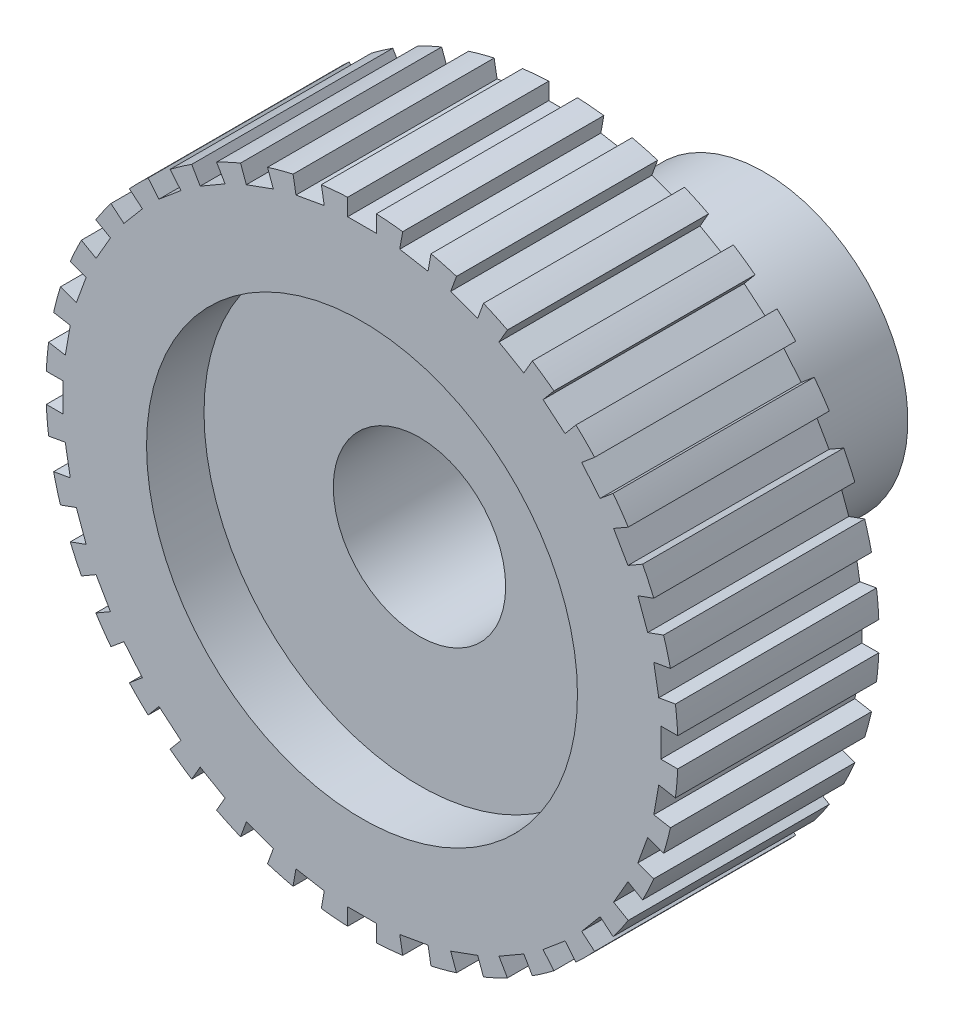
SolidWorks part; units mm, degrees
ref_plane "Plane1" through (0, 0, 0) normal (0, 0, 1) x (1, 0, 0)
ref_plane "Plane2" through (0, 0, 0) normal (0, 1, 0) x (1, 0, 0)
ref_plane "Plane3" through (0, 0, 0) normal (1, 0, 0) x (0, 0, -1)
sketch "Esquisse1" plane through (0, 0, 0) normal (0, 0, 1) x (1, 0, 0)
  circle A0 centre (0, 0) radius 11
  dimension "D1" = 22
extrude "Base-Extrusion" add sketch "Esquisse1" along normal blind 7
sketch "Esquisse2" plane through (0, 0, 7) normal (0, 0, 1) x (1, 0, 0)
  circle A0 centre (0, 0) radius 7.5
  dimension "D1" = 15
extrude "Enlèv. mat.-Extru.1" cut sketch "Esquisse2" against normal blind 2
sketch "Esquisse3" plane through (0, 0, 0) normal (0, 0, -1) x (-1, 0, 0)
  circle A0 centre (0, 0) radius 7.5
  dimension "D1" = 15
extrude "Enlèv. mat.-Extru.2" cut sketch "Esquisse3" against normal blind 1
sketch "Esquisse4" plane through (0, 0, 1) normal (0, 0, -1) x (-1, 0, 0)
  circle A0 centre (0, 0) radius 5
  dimension "D1" = 10
extrude "Boss.-Extru.1" add sketch "Esquisse4" along normal blind 8
sketch "Esquisse5" plane through (0, 0, -7) normal (0, 0, -1) x (-1, 0, 0)
  circle A0 centre (0, 0) radius 3
  dimension "D1" = 6
extrude "Enlèv. mat.-Extru.3" cut sketch "Esquisse5" against normal blind 18
sketch "Esquisse6" plane through (0, 0, 7) normal (0, 0, 1) x (1, 0, 0)
  line L0 (0, 0) -> (0, 12.6) construction
  line L1 (-0.5, 11.4) -> (0.5, 11.4)
  line L2 (-0.5, 11.4) -> (-0.5, 10.4)
  line L3 (0.5, 10.4) -> (-0.5, 10.4)
  line L4 (0.5, 10.4) -> (0.5, 11.4)
  circle A0 centre (0, 0) radius 11 construction
  dimension "D1" = 1
  dimension "D2" = 0.5
  dimension "D3" = 1
  dimension "D4" = 10.4
extrude "Enlèv. mat.-Extru.4" cut sketch "Esquisse6" against normal blind 18
pattern_circular "Répétition circulaire1" count 36 every 10 about axis through (0, 0, 0) along (0, 0, 1) of "Enlèv. mat.-Extru.4"
sketch "Esquisse8" plane through (0, 0, 5) normal (0, 0, 1) x (1, 0, 0)
  circle A0 centre (0, 0) radius 11.5
extrude "Extrusion1" add sketch "Esquisse8" along normal blind 10
sketch "Esquisse9" plane through (0, 0, 0) normal (0, 0, -1) x (-1, 0, 0)
  circle A0 centre (0, 0) radius 11.5
